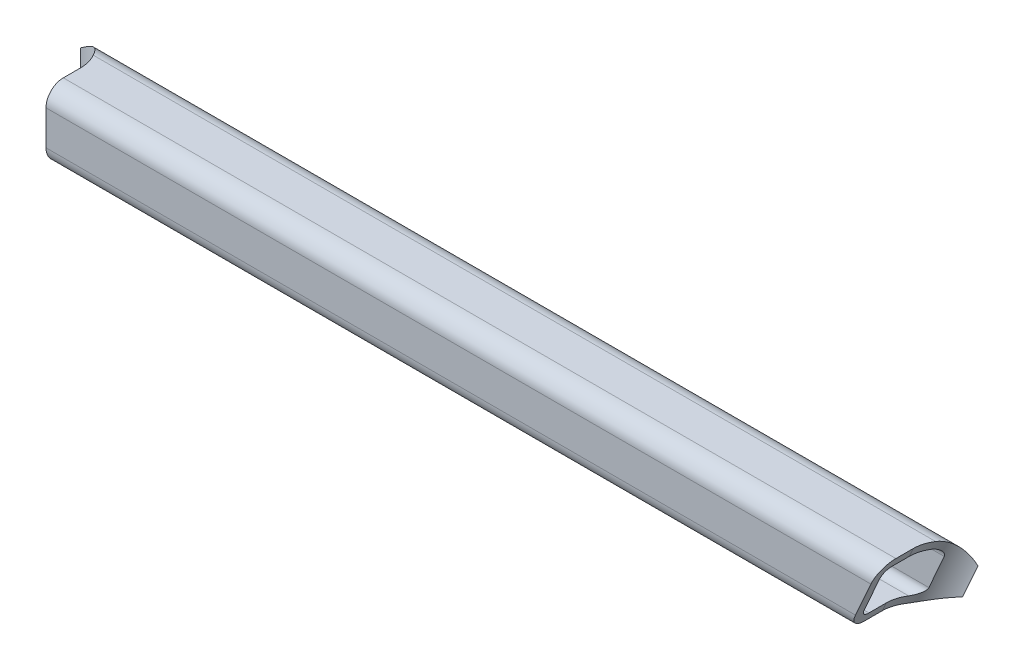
SolidWorks part; units mm, degrees
ref_plane "Front Plane" through (0, 0, 0) normal (0, 0, 1) x (1, 0, 0)
ref_plane "Top Plane" through (0, 0, 0) normal (0, 1, 0) x (1, 0, 0)
ref_plane "Right Plane" through (0, 0, 0) normal (1, 0, 0) x (0, 0, -1)
sketch "Sketch1" plane through (0, 0, 0) normal (0, 0, 1) x (1, 0, 0)
  line L0 (-864.4617, -885.406) -> (-200.3051, -885.406)
  line L1 (-864.4617, -2097.1216) -> (-864.4617, -382.6216) construction
  line L2 (-1162.9117, -885.406) -> (70.773, -885.406) construction
  line L3 (-739.6935, -2097.1216) -> (23.5065, -382.6216) construction
other "Structural Member1"
ref_plane "Plane1" through (-864.4617, -885.406, 0) normal (1, 0, 0) x (0, 1, 0)
sketch "Sketch11" plane through (-864.4617, -885.406, 0) normal (1, 0, 0) x (0, 1, 0)
  line L0 (-12.7, -19.05) -> (12.7, -19.05)
  line L1 (-19.05, -12.7) -> (-19.05, 12.7)
  line L2 (12.7, 19.05) -> (-12.7, 19.05)
  line L3 (19.05, 12.7) -> (19.05, -12.7)
  line L4 (-12.7, -25.4) -> (12.7, -25.4)
  line L5 (-25.4, -12.7) -> (-25.4, 12.7)
  line L6 (12.7, 25.4) -> (-12.7, 25.4)
  line L7 (25.4, 12.7) -> (25.4, -12.7)
  line L8 (-25.4, 0) -> (-19.05, 0) construction
  line L9 (-19.05, 0) -> (19.05, 0) construction
  line L10 (19.05, 0) -> (25.4, 0) construction
  line L11 (0, 25.4) -> (0, 19.05) construction
  line L12 (0, 19.05) -> (0, -19.05) construction
  line L13 (0, -19.05) -> (0, -25.4) construction
  arc A0 (25.4, 12.7) -> (12.7, 25.4) centre (12.7, 12.7) ccw
  arc A1 (12.7, -25.4) -> (25.4, -12.7) centre (12.7, -12.7) ccw
  arc A2 (-25.4, -12.7) -> (-12.7, -25.4) centre (-12.7, -12.7) ccw
  arc A3 (-12.7, 25.4) -> (-25.4, 12.7) centre (-12.7, 12.7) ccw
  arc A4 (-12.7, 19.05) -> (-19.05, 12.7) centre (-12.7, 12.7) ccw
  arc A5 (19.05, 12.7) -> (12.7, 19.05) centre (12.7, 12.7) ccw
  arc A6 (12.7, -19.05) -> (19.05, -12.7) centre (12.7, -12.7) ccw
  arc A7 (-19.05, -12.7) -> (-12.7, -19.05) centre (-12.7, -12.7) ccw
  point P6 (-25.4, -25.4)
  point P33 (-25.4, 25.4)
  point P35 (25.4, 25.4)
  point P36 (25.4, -25.4)
  point P37 (0, 0)
  dimension "D1" = 12.7
  dimension "Thickness" = 6.35
  dimension "V_leg" = 50.8
  dimension "H_leg" = 50.8
other "Trim/Extend1"
other "Trim/Extend2"
